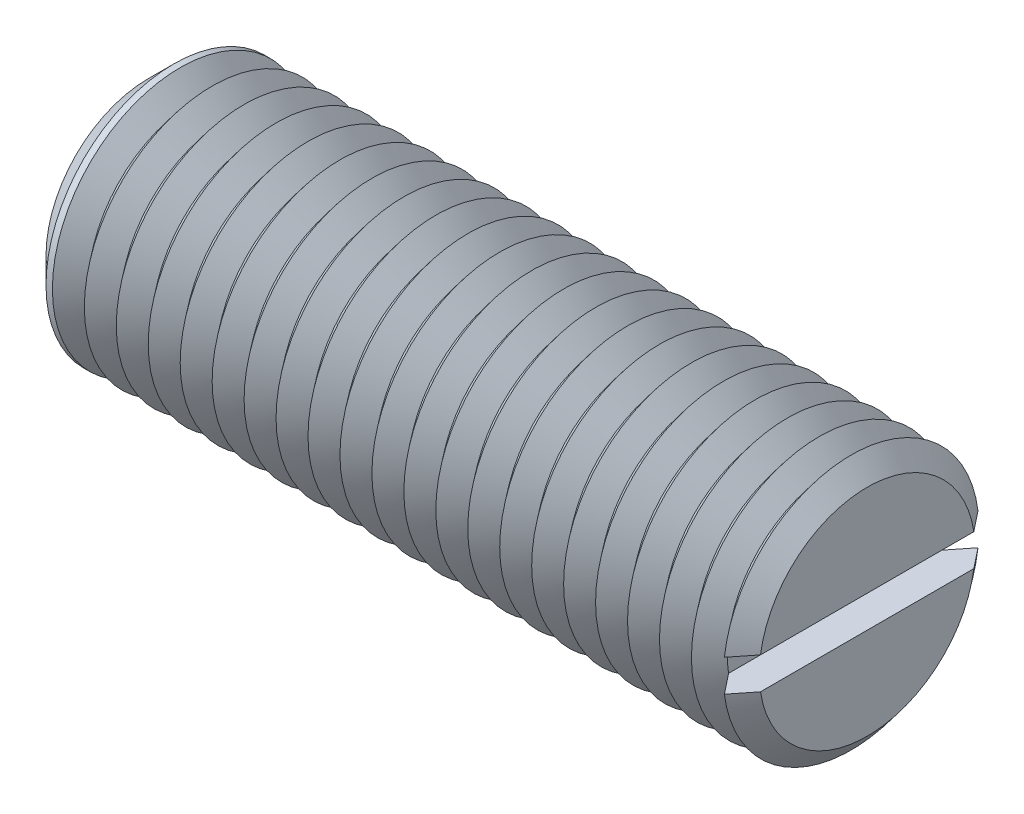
SolidWorks part; units mm, degrees
ref_plane "Front Plane" through (0, 0, 0) normal (0, 0, 1) x (1, 0, 0)
ref_plane "Top Plane" through (0, 0, 0) normal (0, 1, 0) x (1, 0, 0)
ref_plane "Right Plane" through (0, 0, 0) normal (1, 0, 0) x (0, 0, -1)
sketch "Sketch1" plane through (0, 0, 0) normal (1, 0, 0) x (0, 0, -1)
  circle A0 centre (0, 0) radius 8
  dimension "D1" = 16
extrude "Extrude1" add sketch "Sketch1" along normal mid plane 45
sketch "Sketch2" plane through (0, 0, 0) normal (0, 0, 1) x (1, 0, 0)
  line L0 (22.5, 1) -> (20.5, 1)
  line L1 (22.5, -8) -> (22.5, 8) construction
  line L2 (20.5, 1) -> (20.5, -1)
  line L3 (0, 0) -> (50000, 0) construction
  line L4 (22.5, -1) -> (20.5, -1)
  line L5 (22.5, -1) -> (22.5, 1)
  point P9 (20.5, 0)
  dimension "D1" = 2
extrude "Extrude2" cut sketch "Sketch2" against normal mid plane 24
chamfer "Chamfer1" distance 1.6 angle 45 1 edges at (-22.5, 0, -8)
sketch "Sketch3" plane through (0, 0, 0) normal (0, 0, 1) x (1, 0, 0)
  line L0 (0, 0) -> (30.9602, 0) construction
  line L1 (21.5, -8) -> (23.5, -8)
  line L2 (-20.9, -8) -> (22.5, -8) construction
  line L3 (23.5, -8) -> (22.5, -6.751)
  line L4 (22.5, -8) -> (22.5, -1) construction
  line L5 (22.5, -6.751) -> (21.5, -8)
  dimension "D1" = 2
  dimension "D2" = 1.6
revolve "Cut-Revolve1" cut sketch "Sketch3" angle 360 about L0
pattern_linear "LPattern1" count 22 spacing 2 along (-1, 0, 0) of "Cut-Revolve1"
equation "\"D2@Sketch3\" = \"D1@Sketch3\"*0.8"
